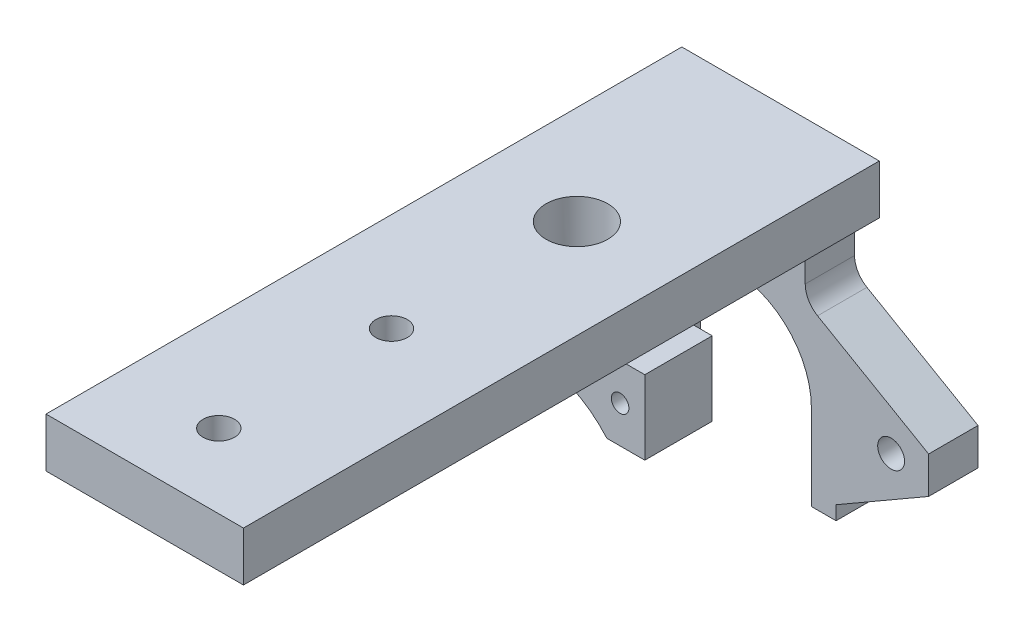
SolidWorks part; units mm, degrees
ref_plane "Front Plane" through (0, 0, 0) normal (0, 0, 1) x (1, 0, 0)
ref_plane "Top Plane" through (0, 0, 0) normal (0, 1, 0) x (1, 0, 0)
ref_plane "Right Plane" through (0, 0, 0) normal (1, 0, 0) x (0, 0, -1)
sketch "Sketch1" plane through (0, 0, 0) normal (1, 0, 0) x (0, 0, -1)
  line L0 (0, 0) -> (-81.788, 0)
  line L1 (0, 0) -> (0, -36.5125)
  line L2 (-6.35, -6.35) -> (-81.788, -6.35)
  line L3 (-6.35, -6.35) -> (-6.35, -36.5125)
  line L4 (-81.788, -6.35) -> (-81.788, 0)
  line L5 (-6.35, -36.5125) -> (0, -36.5125)
  dimension "D2" = 81.788
  dimension "D3" = 36.5125
  dimension "D1" = 6.35
extrude "Extrude1" add sketch "Sketch1" along normal mid plane 50.8
sketch "Sketch2" plane through (0, 0, 0) normal (0, 0, -1) x (-1, 0, 0)
  line L0 (-25.4, 0) -> (25.4, 0) construction
  line L1 (-10.3187, -25.5016) -> (-10.3187, -41.3766)
  line L2 (10.3187, -25.5016) -> (10.3187, -41.3766)
  line L3 (10.3187, -41.3766) -> (-10.3187, -41.3766)
  arc A0 (10.3187, -25.5016) -> (-10.3187, -25.5016) centre (0, -25.5016) ccw
  dimension "D2" = 10.3187
  dimension "D1" = 25.5016
extrude "Cut-Extrude1" cut sketch "Sketch2" against normal up to next
sketch "Sketch6" plane through (0, -6.35, 0) normal (0, -1, 0) x (1, 0, 0)
  line L0 (25.4, 6.35) -> (10.3187, 6.35) construction
  line L1 (25.4, 81.788) -> (12.7, 81.788)
  line L2 (25.4, 81.788) -> (25.4, 6.35)
  line L3 (25.4, 6.35) -> (12.7, 6.35)
  line L4 (12.7, 81.788) -> (12.7, 6.35)
  line L5 (25.4, 6.35) -> (-25.4, 6.35) construction
  line L6 (-25.4, 81.788) -> (-12.7, 81.788)
  line L7 (-25.4, 81.788) -> (-25.4, 6.35)
  line L8 (-25.4, 6.35) -> (-12.7, 6.35)
  line L9 (-12.7, 81.788) -> (-12.7, 6.35)
  dimension "D1" = 12.7
  dimension "D2" = 12.7
  dimension "D3" = 25.4
extrude "Cut-Extrude2" cut sketch "Sketch6" against normal through all
sketch "Sketch7" plane through (12.7, 0, 0) normal (1, 0, 0) x (0, 0, -1)
  line L0 (-81.788, -6.35) -> (-6.35, -6.35) construction
  line L1 (-23.8696, -6.35) -> (-32.5437, -6.35)
  line L2 (-23.8696, -6.35) -> (-23.8696, -15.875)
  line L3 (-23.8696, -15.875) -> (-32.5437, -15.875)
  line L4 (-32.5437, -6.35) -> (-32.5437, -15.875)
  line L5 (0, -36.5125) -> (0, 0) construction
  dimension "D1" = 9.525
  dimension "D2" = 8.6741
  dimension "D3" = 32.5438
extrude "Extrude2" add sketch "Sketch7" against normal blind 27.7812 and the other way blind 2.3812
sketch "Sketch11" plane through (0, 0, 32.5437) normal (0, 0, 1) x (1, 0, 0)
  circle A0 centre (0, -24.7079) radius 13.4938
  arc A1 (10.3188, -25.5016) -> (-10.3187, -25.5016) centre (0, -25.5016) ccw construction
  dimension "D1" = 13.4937
  dimension "D2" = 0.7937
extrude "Cut-Extrude4" cut sketch "Sketch11" against normal up to next
hole_wizard "#4-40 Tapped Hole1" positions "Sketch16" profile "Sketch15" tap size "#4-40" standard "ANSI Inch"
sketch "Sketch16" plane through (0, 0, 32.5437) normal (0, 0, 1) x (1, 0, 0)
  line L0 (-12.7, -6.35) -> (12.7, -6.35) construction
  point P0 (-11.9062, -11.1125)
  point P1 (11.9063, -11.1125)
  dimension "D1" = 4.7625
  dimension "D2" = 11.9062
  dimension "D3" = 11.9062
sketch "Sketch15" plane through (-11.9063, -11.1125, 32.5437) normal (1, 0, 0) x (0, -1, 0)
  line L0 (0, 0) -> (0, 8.6741)
  line L1 (0, 8.6741) -> (1.1303, 8.6741)
  line L2 (1.1303, 8.6741) -> (1.1303, 0)
  line L5 (1.1303, 0) -> (0, 0)
  line L11 (0, -6.35) -> (0, 107.95) construction
  dimension "Thru Tap Drill Dia." = 2.2606
  dimension "Thru Tap Drill Depth" = 8.6741
hole_wizard "#8-32 Tapped Hole4" positions "3DSketch1" profile "Sketch3" tap size "#8-32" standard "Ansi Inch"
sketch3d "3DSketch1"
  line L0 (25.4, 0, 0) -> (-25.4, 0, 0) construction
  circle A0 centre (0, -25.5016, 0) radius 10.3187 construction
  point P0 (20.574, -25.4889, 0)
  point P2 (-20.574, -25.4889, 0)
  point P11 (0, -25.5016, -10.3188)
  dimension "D1" = 41.148
  dimension "D2" = 25.4889
  dimension "D3" = 20.574
sketch "Sketch3" plane through (20.574, -25.4889, 0) normal (1, 0, 0) x (0, 1, 0)
  line L0 (0, 0) -> (0, 6.7754)
  line L1 (0, 6.7754) -> (1.7272, 6.7754)
  line L2 (1.7272, 6.7754) -> (1.7272, 0)
  line L5 (1.7272, 0) -> (0, 0)
  line L10 (0, 6.7754) -> (-1.7272, 6.7754) construction
  line L11 (0, -6.35) -> (0, 107.95) construction
  dimension "Tap Drill Dia." = 3.4544
  dimension "Tap Drill Depth" = 6.7754
  dimension "Drill Angle" = 180
sketch "Sketch8" plane through (0, -15.875, 0) normal (0, -1, 0) x (1, 0, 0)
  circle A0 centre (0, 26.1937) radius 3.9688
  dimension "D1" = 7.9375
  dimension "D2" = 26.1937
extrude "Cut-Extrude3" cut sketch "Sketch8" against normal up to next
hole_wizard "#8-32 Tapped Hole2" positions "3DSketch5" profile "Sketch10" tap size "#8-32" standard "Ansi Inch"
sketch3d "3DSketch5"
  line L0 (25.4, 0, 0) -> (-25.4, 0, 0) construction
  line L1 (0, 0, 0) -> (0, 0, 81.788) construction
  line L2 (13.4937, 0, 81.788) -> (-13.4938, 0, 81.788) construction
  point P0 (-6.35, 0, 36.957)
  point P2 (6.35, 0, 36.957)
  point P4 (6.35, 0, 75.7428)
  point P6 (-6.35, 0, 75.7428)
  dimension "D1" = 36.957
  dimension "D2" = 38.7858
  dimension "D3" = 6.35
  dimension "D4" = 12.7
sketch "Sketch10" plane through (-6.35, 0, 36.957) normal (1, 0, 0) x (0, 0, 1)
  line L0 (0, 0) -> (0, 6.35)
  line L1 (0, 6.35) -> (1.7272, 6.35)
  line L2 (1.7272, 6.35) -> (1.7272, 0)
  line L5 (1.7272, 0) -> (0, 0)
  line L11 (0, -6.35) -> (0, 107.95) construction
  dimension "Thru Tap Drill Dia." = 3.4544
  dimension "Thru Tap Drill Depth" = 6.35
hole_wizard "#10-32 Tapped Hole1" positions "Sketch14" profile "Sketch13" tap size "#10-32" standard "Ansi Inch"
sketch "Sketch14" plane through (0, 0, 0) normal (0, 1, 0) x (-1, 0, 0)
  line L0 (-12.7, 81.788) -> (12.7, 81.788) construction
  point P0 (0, 72.263)
  point P1 (0, 50.038)
  dimension "D1" = 9.525
  dimension "D2" = 22.225
sketch "Sketch13" plane through (0, 0, 72.263) normal (1, 0, 0) x (0, 0, 1)
  line L0 (0, 0) -> (0, 36.5125)
  line L1 (0, 36.5125) -> (2.0193, 36.5125)
  line L2 (2.0193, 36.5125) -> (2.0193, 0)
  line L5 (2.0193, 0) -> (0, 0)
  line L11 (0, -6.35) -> (0, 107.95) construction
  dimension "Thru Tap Drill Dia." = 4.0386
  dimension "Thru Tap Drill Depth" = 36.5125
sketch "Sketch12" plane through (0, 0, 0) normal (0, 0, 1) x (1, 0, 0)
  line L0 (12.7, 0) -> (12.7, -6.35) construction
  line L1 (12.7, 0) -> (12.7, -6.35)
  line L2 (25.4, -27.8511) -> (13.4938, -34.7252)
  line L3 (9.525, -9.525) -> (9.525, -12.1189)
  line L4 (12.7, 0) -> (25.4, 0)
  line L5 (25.4, 0) -> (25.4, -23.1175)
  line L6 (0, 0) -> (0, 8.2533) construction
  line L7 (-13.4938, -34.7252) -> (-13.4937, -36.5125)
  line L8 (-25.4, -36.5125) -> (-25.4, -27.8511)
  line L9 (-13.4937, -36.5125) -> (-25.4, -36.5125)
  line L10 (-25.4, -23.1175) -> (-11.1125, -14.8686)
  line L11 (25.4, -23.1175) -> (11.1125, -14.8686)
  line L12 (25.4, -36.5125) -> (25.4, 0) construction
  line L14 (13.4937, -36.5125) -> (25.4, -36.5125)
  line L15 (25.4, -36.5125) -> (25.4, -27.8511)
  line L16 (13.4938, -34.7252) -> (13.4937, -36.5125)
  line L18 (-12.7, 0) -> (-25.4, 0)
  line L19 (-25.4, -27.8511) -> (-13.4938, -34.7252)
  line L20 (-12.7, 0) -> (-12.7, -6.35)
  line L23 (-9.525, -9.525) -> (-9.525, -12.1189)
  line L24 (-25.4, 0) -> (-25.4, -23.1175)
  arc A0 (-9.525, -9.525) -> (-12.7, -6.35) centre (-12.7, -9.525) ccw
  arc A1 (11.1125, -14.8686) -> (9.525, -12.1189) centre (12.7, -12.1189) cw
  circle A3 centre (20.574, -25.4889) radius 1.7272 construction
  arc A4 (9.525, -9.525) -> (12.7, -6.35) centre (12.7, -9.525) cw
  arc A5 (-11.1125, -14.8686) -> (-9.525, -12.1189) centre (-12.7, -12.1189) ccw
  dimension "D1" = 6.35
  dimension "D3" = 120
  dimension "D2" = 9.525
  dimension "D5" = 2.3714
  dimension "D6" = 2.3622
  dimension "D7" = 3.175
  dimension "D8" = 3.175
  dimension "D4" = 30
extrude "Cut-Extrude5" cut sketch "Sketch12" along normal up to next
